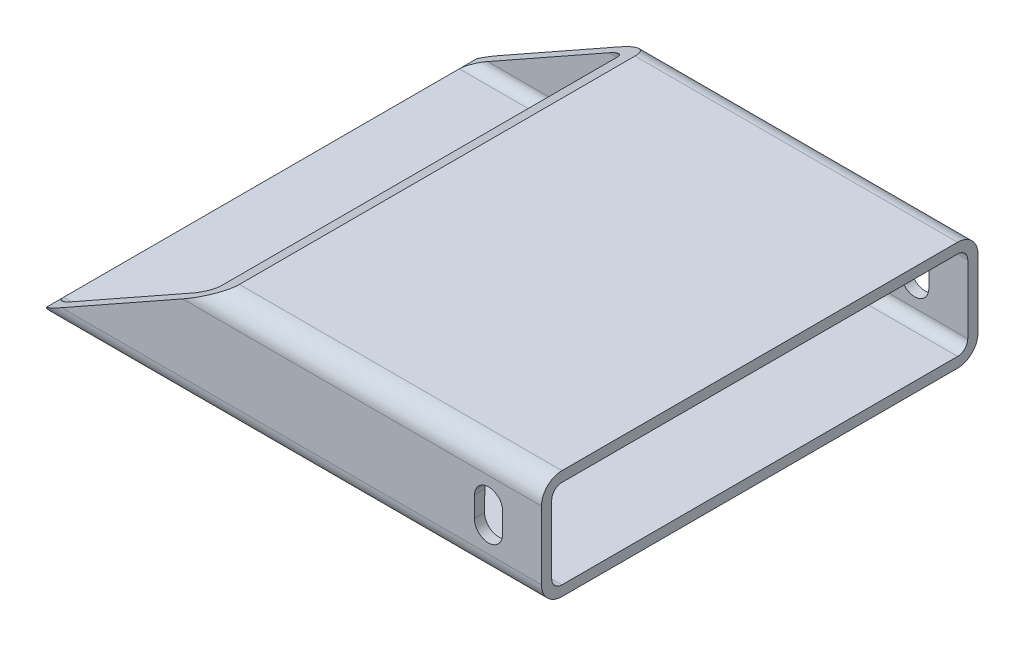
SolidWorks part; units mm, degrees
ref_plane "Front Plane" through (0, 0, 0) normal (1, 0, 0) x (0, 1, 0)
ref_plane "Top Plane" through (0, 0, 0) normal (0, 0, 1) x (0, 1, 0)
ref_plane "Right Plane" through (0, 0, 0) normal (0, 1, 0) x (-1, 0, 0)
sketch "sk 8x2x0.1875"
  point P0 (0, -101.6)
  point P1 (-25.4, 0)
sketch_block_instance "8x2x0.1875-1"
sketch_block "8x2x0.1875" parameters "D1"=9.525, "D2"=4.7625, "D3"=4.7625, "D4"=4.7625, "D5"=203.2, "D6"=50.8, "D7"=41.275, "D8"=193.675
extrude "8x2" add sketch "sk 8x2x0.1875" along normal blind 231.918
sketch "Sketch2"
  dimension "D1" = 207.264
sketch_block_instance "Block2-1"
sketch_block "Block2" parameters "D1"=6.5484, "D2"=9.525
extrude "Cut-Extrude1" cut sketch "Sketch2" against normal through all both and the other way through all
sketch "sk W730"
  point P0 (150.114, -172.974)
  dimension "D1" = 25.4
sketch_block_instance "W14x730-1"
sketch_block "W14x730" parameters "D4"=15.24, "D1"=454.406, "D2"=569.468, "D3"=77.978, "D5"=124.714
sketch "sk W193"
sketch_block_instance "w14x193-2"
sketch_block "w14x193" parameters "D4"=15.24, "D1"=399.034, "D2"=393.192, "D3"=22.606, "D5"=36.576
sketch "Sketch5" plane through (0, 0, 0) normal (0, 0, 1) x (0, 1, 0)
  line L0 (-20.6375, 0) -> (25.4, -81.788)
  line L1 (25.4, -81.788) -> (25.4, 0)
  line L2 (25.4, 0) -> (-20.6375, 0)
  line L5 (331.216, -145.288) -> (294.64, -145.288) construction
  line L7 (-25.4, 27.686) -> (-25.4, -145.288) construction
  dimension "D1" = 4.7625
  dimension "D2" = 63.5
  dimension "D3" = 25.4
extrude "Cut-Extrude2" cut sketch "Sketch5" against normal through all both and the other way through all
